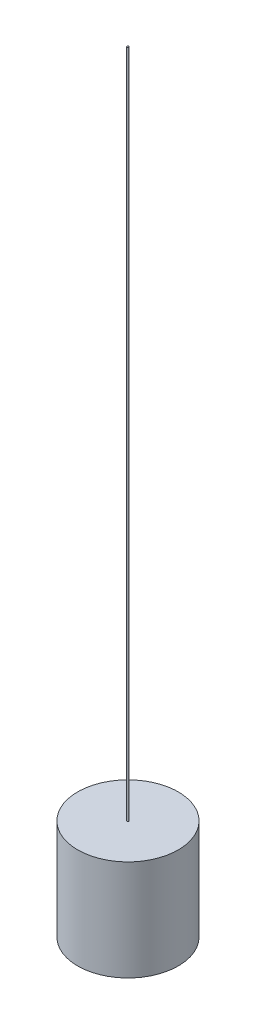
SolidWorks part; units mm, degrees
ref_plane "Front Plane" through (0, 0, 0) normal (0, 0, 1) x (1, 0, 0)
ref_plane "Top Plane" through (0, 0, 0) normal (0, 1, 0) x (1, 0, 0)
ref_plane "Right Plane" through (0, 0, 0) normal (1, 0, 0) x (0, 0, -1)
sketch "Sketch2" plane through (0, 0, 0) normal (0, 1, 0) x (1, 0, 0)
  circle A0 centre (0, 0) radius 7.5
  dimension "D1" = 15
extrude "Boss-Extrude1" add sketch "Sketch2" along normal blind 15
sketch "Sketch3" plane through (0, 15, 0) normal (0, 1, 0) x (1, 0, 0)
  circle A0 centre (0, 0) radius 0.1313
extrude "Boss-Extrude2" add sketch "Sketch3" along normal blind 100
